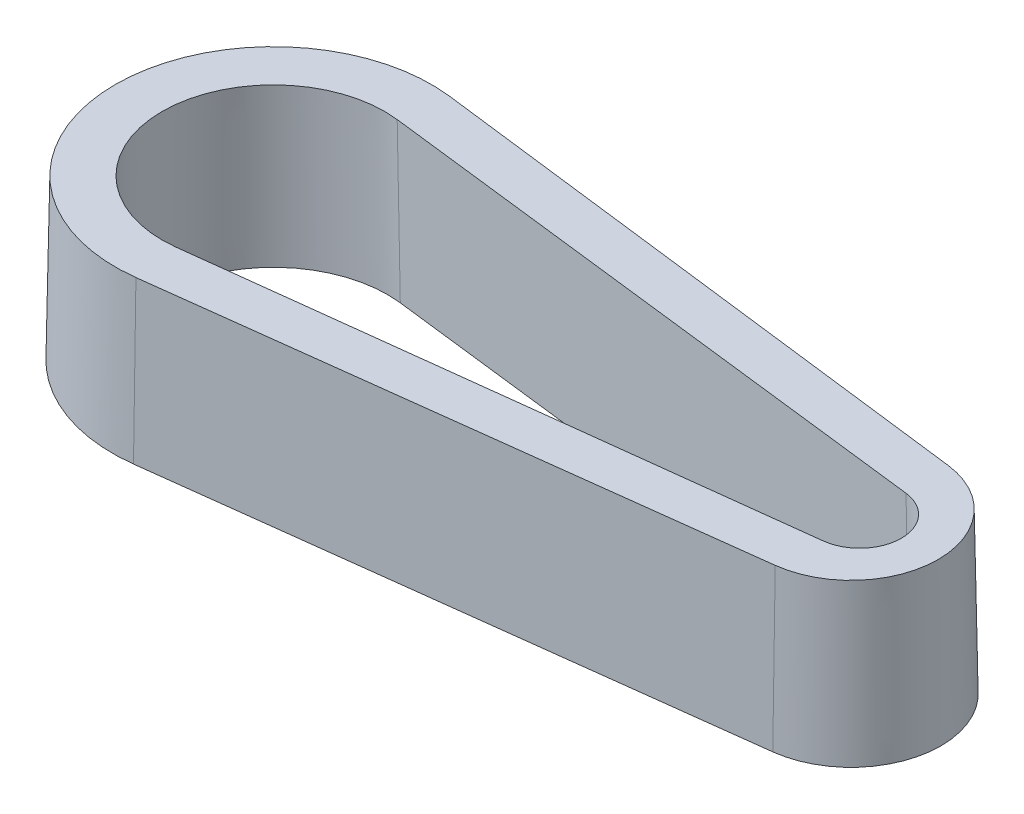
SolidWorks part; units mm, degrees
ref_plane "Front Plane" through (0, 0, 0) normal (0, 0, 1) x (1, 0, 0)
ref_plane "Top Plane" through (0, 0, 0) normal (0, 1, 0) x (1, 0, 0)
ref_plane "Right Plane" through (0, 0, 0) normal (1, 0, 0) x (0, 0, -1)
sketch "Sketch1" plane through (0, 0, 0) normal (0, 1, 0) x (1, 0, 0)
  line L0 (0, 0) -> (139.1765, 0) construction
  line L1 (0.9691, 8.0956) -> (42.262, 3.1525)
  line L2 (0.9691, -8.0956) -> (42.262, -3.1525)
  line L3 (1.4115, 11.4065) -> (42.0515, 6.3776)
  line L4 (1.4115, -11.4065) -> (42.0515, -6.3776)
  arc A0 (0.9691, 8.0956) -> (0.9691, -8.0956) centre (0, 0) ccw
  arc A1 (42.262, -3.1525) -> (42.262, 3.1525) centre (41.8846, 0) ccw
  arc A2 (1.4115, 11.4065) -> (1.4115, -11.4065) centre (0, 0) ccw
  arc A3 (42.0515, -6.3776) -> (42.0515, 6.3776) centre (41.2623, 0) ccw
  dimension "D1" = 16.3068
  dimension "D2" = 6.35
  dimension "D3" = 53.213
  dimension "D4" = 22.987
  dimension "D5" = 12.8524
  dimension "D6" = 59.182
extrude "Boss-Extrude1" add sketch "Sketch1" along normal blind 11.43
draft "Draft1" type of draft neutral plane draft angle 1 faces to draft 4 parameters "D1"=1
draft "Draft4" type of draft neutral plane draft angle 1 faces to draft 4 parameters "D1"=1
